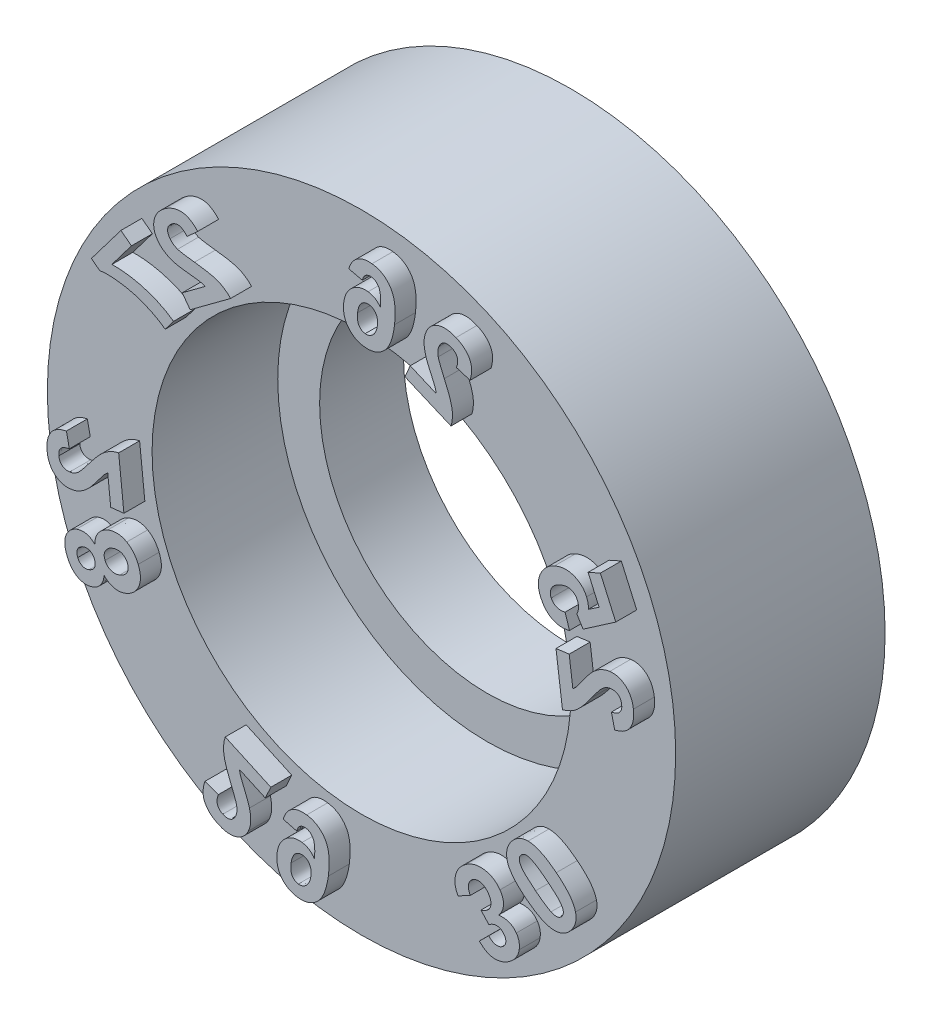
SolidWorks part; units mm, degrees
ref_plane "Front Plane" through (0, 0, 0) normal (0, 0, 1) x (1, 0, 0)
ref_plane "Top Plane" through (0, 0, 0) normal (0, 1, 0) x (1, 0, 0)
ref_plane "Right Plane" through (0, 0, 0) normal (1, 0, 0) x (0, 0, -1)
imported_body "Imported1"
other "DeleteFace2"
sketch "Sketch1" plane through (0, 0, 0) normal (0, 0, 1) x (1, 0, 0)
  line L0 (0, 0) -> (0, 8.7827) construction
  line L1 (0, 0) -> (7.606, 4.3913) construction
  line L2 (0, 0) -> (7.606, -4.3913) construction
  line L3 (0, 0) -> (0, -8.7827) construction
  line L4 (0, 0) -> (-7.606, -4.3913) construction
  line L5 (0, 0) -> (-7.606, 4.3913) construction
  circle A0 centre (0, 0) radius 5.3057 construction
  text T0 "25   26   27   28   29   30" font "Arial" height 1.8
  point P11 (0, 0)
  dimension "D1" = 6
extrude "Boss-Extrude1" add sketch "Sketch1" along normal blind 0.5
